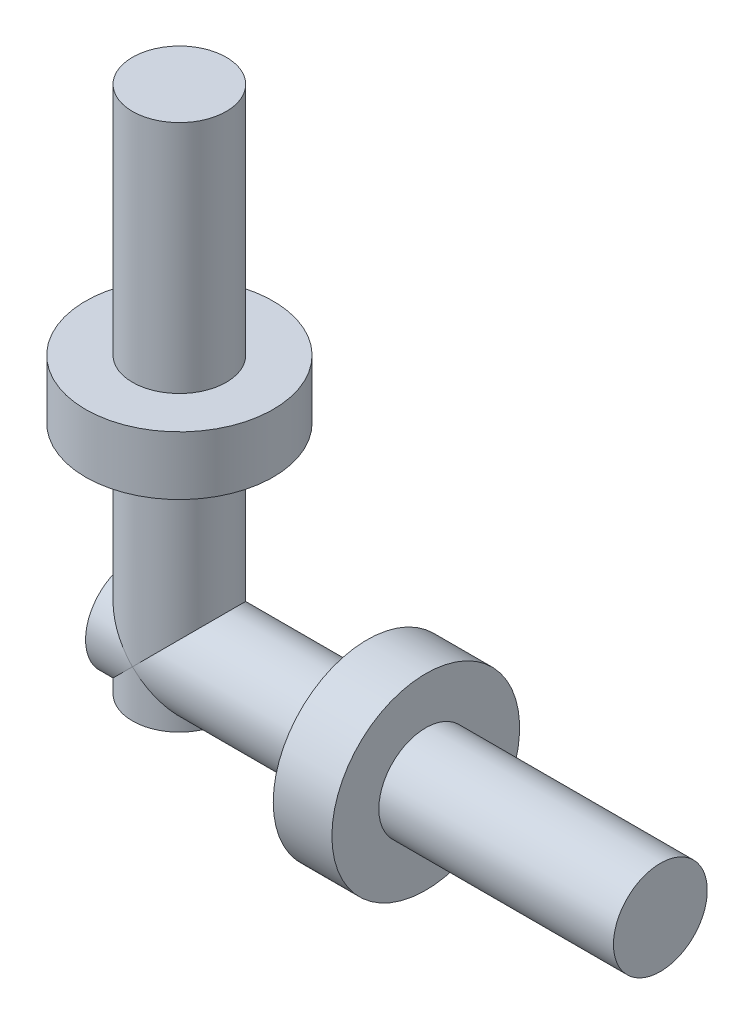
SolidWorks part; units mm, degrees
ref_plane "前视基准面" through (0, 0, 0) normal (0, 0, 1) x (1, 0, 0)
ref_plane "上视基准面" through (0, 0, 0) normal (0, 1, 0) x (1, 0, 0)
ref_plane "右视基准面" through (0, 0, 0) normal (1, 0, 0) x (0, 0, -1)
other "Configuration Table"
sketch "草图1" plane through (0, 0, 0) normal (0, 1, 0) x (1, 0, 0)
  circle A0 centre (0, 0) radius 4
extrude "凸台-拉伸1" add sketch "草图1" along normal blind 2.5
sketch "草图2" plane through (0, 2.5, 0) normal (0, 1, 0) x (1, 0, 0)
  circle A0 centre (0, 0) radius 2
extrude "凸台-拉伸2" add sketch "草图2" along normal blind 10
sketch "草图3" plane through (0, 0, 0) normal (0, -1, 0) x (1, 0, 0)
  circle A0 centre (0, 0) radius 2
extrude "凸台-拉伸3" add sketch "草图3" along normal blind 10
sketch3d "3D草图1"
  line L0 (-2, -10, 0) -> (2.0367, -5.9633, 0)
  circle A0 centre (0, -10, 0) radius 2 construction
  point P4 (0, -12, 0)
ref_plane "基准面1" through (4, -4, 0) normal (0.7071, -0.7071, 0) x (0.7071, 0.7071, 0)
mirror "镜向1" about plane through (4, -4, 0) normal (0.7071, -0.7071, 0) of "凸台-拉伸3", "凸台-拉伸1", "凸台-拉伸2"
mirror "镜向3" about plane through (4, -4, 0) normal (0.7071, -0.7071, 0) of "凸台-拉伸1"
mirror "镜向4" about plane through (4, -4, 0) normal (0.7071, -0.7071, 0) of "凸台-拉伸2", "镜向3"
